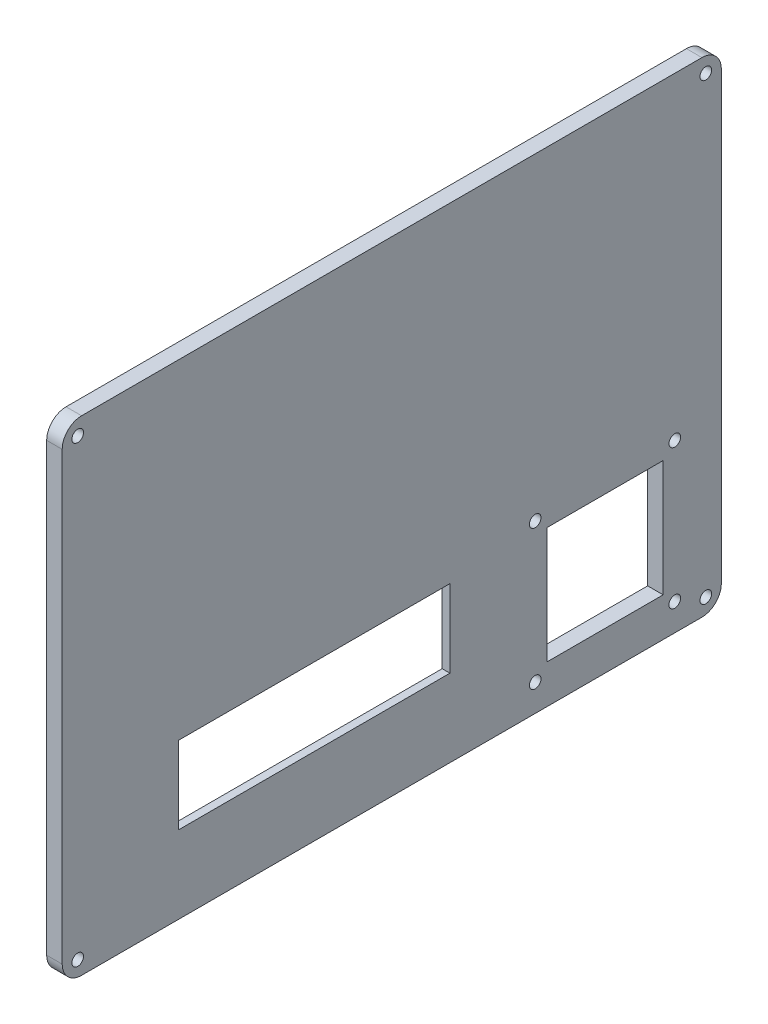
SolidWorks part; units mm, degrees
ref_plane "Front Plane" through (0, 0, 0) normal (0, 0, 1) x (1, 0, 0)
ref_plane "Top Plane" through (0, 0, 0) normal (0, 1, 0) x (1, 0, 0)
ref_plane "Right Plane" through (0, 0, 0) normal (1, 0, 0) x (0, 0, -1)
sketch "Sketch1" plane through (0, 0, 0) normal (1, 0, 0) x (0, 0, -1)
  line L0 (85, -62.5) -> (70, -62.5) construction
  line L1 (-85, 62.5) -> (85, 62.5)
  line L2 (-85, 62.5) -> (-85, -62.5)
  line L3 (-85, -62.5) -> (85, -62.5)
  line L4 (85, 62.5) -> (85, -62.5)
  line L5 (-85, 62.5) -> (85, -62.5) construction
  line L6 (-85, -62.5) -> (85, 62.5) construction
  line L7 (70, -62.5) -> (70, -52.5) construction
  line L8 (40, -52.5) -> (15, -52.5) construction
  line L9 (70, -52.5) -> (40, -52.5)
  line L10 (70, -52.5) -> (70, -22.5)
  line L11 (70, -22.5) -> (40, -22.5)
  line L12 (40, -52.5) -> (40, -22.5)
  line L13 (15, -62.5) -> (15, -42.5) construction
  line L15 (15, -42.5) -> (-55, -42.5)
  line L16 (15, -42.5) -> (15, -22.5)
  line L17 (15, -22.5) -> (-55, -22.5)
  line L18 (-55, -42.5) -> (-55, -22.5)
  point P0 (0, 0)
  dimension "D1" = 170
  dimension "D2" = 125
  dimension "D3" = 15
  dimension "D4" = 10
  dimension "D5" = 30
  dimension "D6" = 30
  dimension "D7" = 25
  dimension "D8" = 20
  dimension "D9" = 20
  dimension "D10" = 70
extrude "Boss-Extrude1" add sketch "Sketch1" along normal blind 4
sketch "Sketch2" plane through (4, 0, 0) normal (1, 0, 0) x (0, 0, -1)
  line L14 (37, -55.5) -> (73, -55.5)
  line L15 (73, -55.5) -> (73, -19.5)
  line L16 (37, -19.5) -> (37, -55.5)
  line L17 (73, -19.5) -> (37, -19.5)
  line L18 (37, -55.5) -> (73, -55.5)
  line L19 (73, -55.5) -> (73, -19.5)
  line L20 (37, -19.5) -> (37, -55.5)
  line L21 (73, -19.5) -> (37, -19.5)
  circle A0 centre (37, -19.5) radius 1.5
  circle A1 centre (73, -19.5) radius 1.5
  circle A2 centre (37, -55.5) radius 1.5
  circle A3 centre (73, -55.5) radius 1.5
  dimension "D2" = 3
  dimension "D3" = 3
  dimension "D4" = 3
  dimension "D5" = 3
  dimension "D1" = 3
extrude "Cut-Extrude1" cut sketch "Sketch2" against normal blind 10 contours L19 A1 L21 | L21 A1 L19 | L20 A0 L21 | L21 A0 L20 | L18 A2 L20 | L20 A2 L18 | L19 A3 L18 | L18 A3 L19
sketch "Sketch3" plane through (4, 0, 0) normal (1, 0, 0) x (0, 0, -1)
  line L4 (0, 58.5) -> (0, 41.1702) construction
  line L5 (-81, 0) -> (-59.0404, 0) construction
  line L8 (81, -58.5) -> (81, 58.5)
  line L9 (81, 58.5) -> (-81, 58.5)
  line L10 (-81, 58.5) -> (-81, -58.5)
  line L11 (-81, -58.5) -> (81, -58.5)
  line L12 (81, -58.5) -> (81, 58.5)
  line L13 (81, 58.5) -> (-81, 58.5)
  line L14 (-81, 58.5) -> (-81, -58.5)
  line L15 (-81, -58.5) -> (81, -58.5)
  circle A0 centre (-81, 58.5) radius 1.5
  circle A1 centre (-81, -58.5) radius 1.5
  circle A2 centre (81, -58.5) radius 1.5
  circle A3 centre (81, 58.5) radius 1.5
  dimension "D2" = 3
  dimension "D1" = 4
extrude "Cut-Extrude2" cut sketch "Sketch3" against normal blind 10 contours L13 A0 L14 | A3 L12 L13 | A3 L13 L12 | L15 A2 L12 | L12 A2 L15 | A1 L15 L14 | A1 L14 L15 | L14 A0 L13
fillet "Fillet1" radius 5 4 edges at (2, -62.5, -85) (2, -62.5, 85) (2, 62.5, 85) (2, 62.5, -85)
sketch "Sketch4" plane through (0, 0, 0) normal (-1, 0, 0) x (0, 0, 1)
  line L8 (58, -45.5) -> (58, -19.5)
  line L9 (-18, -45.5) -> (58, -45.5)
  line L10 (-18, -19.5) -> (-18, -45.5)
  line L11 (58, -19.5) -> (-18, -19.5)
  line L12 (58, -45.5) -> (58, -19.5)
  line L13 (-18, -45.5) -> (58, -45.5)
  line L14 (-18, -19.5) -> (-18, -45.5)
  line L15 (58, -19.5) -> (-18, -19.5)
  dimension "D1" = 3
extrude "Cut-Extrude3" cut sketch "Sketch4" against normal blind 2
